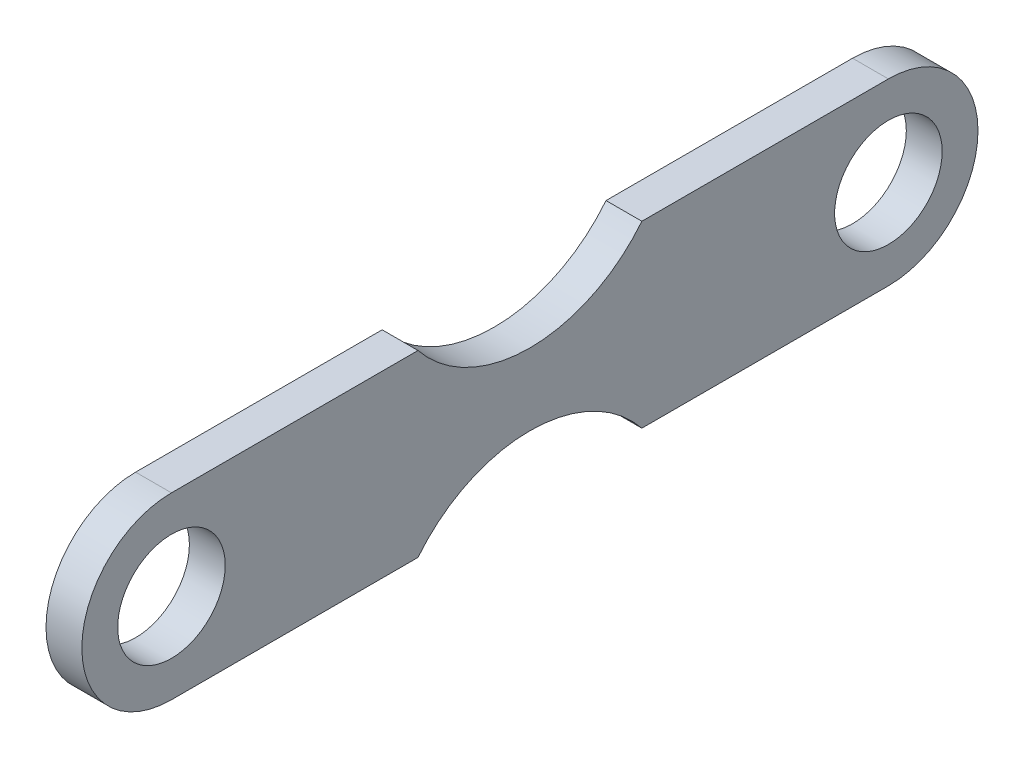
SolidWorks part; units mm, degrees
ref_plane "Front Plane" through (0, 0, 0) normal (0, 0, 1) x (1, 0, 0)
ref_plane "Top Plane" through (0, 0, 0) normal (0, 1, 0) x (1, 0, 0)
ref_plane "Right Plane" through (0, 0, 0) normal (1, 0, 0) x (0, 0, -1)
sketch "Sketch1" plane through (0, 0, 0) normal (1, 0, 0) x (0, 0, -1)
  line L0 (100, 0) -> (-100, 0) construction
  line L1 (100, -25) -> (31.225, -25)
  line L2 (100, 25) -> (31.225, 25)
  line L3 (-31.225, 25) -> (-100, 25)
  line L4 (-31.225, -25) -> (-100, -25)
  arc A0 (100, -25) -> (100, 25) centre (100, 0) ccw
  arc A1 (-100, 25) -> (-100, -25) centre (-100, 0) ccw
  circle A2 centre (-100, 0) radius 15
  circle A3 centre (100, 0) radius 15
  arc A4 (-31.225, 25) -> (31.225, 25) centre (0, 50) ccw
  arc A5 (-31.225, -25) -> (31.225, -25) centre (0, -50) cw
  point P0 (0, 0)
  point P1 (0, 0)
  point P2 (0, 0)
  point P15 (0, 37.2802)
  point P16 (0, 0)
  point P17 (27.3715, 25)
  dimension "D3" = 30
  dimension "D4" = 30
  dimension "D5" = 40
  dimension "D1" = 50
  dimension "D2" = 200
  dimension "D6" = 50
extrude "Boss-Extrude1" add sketch "Sketch1" along normal blind 10
